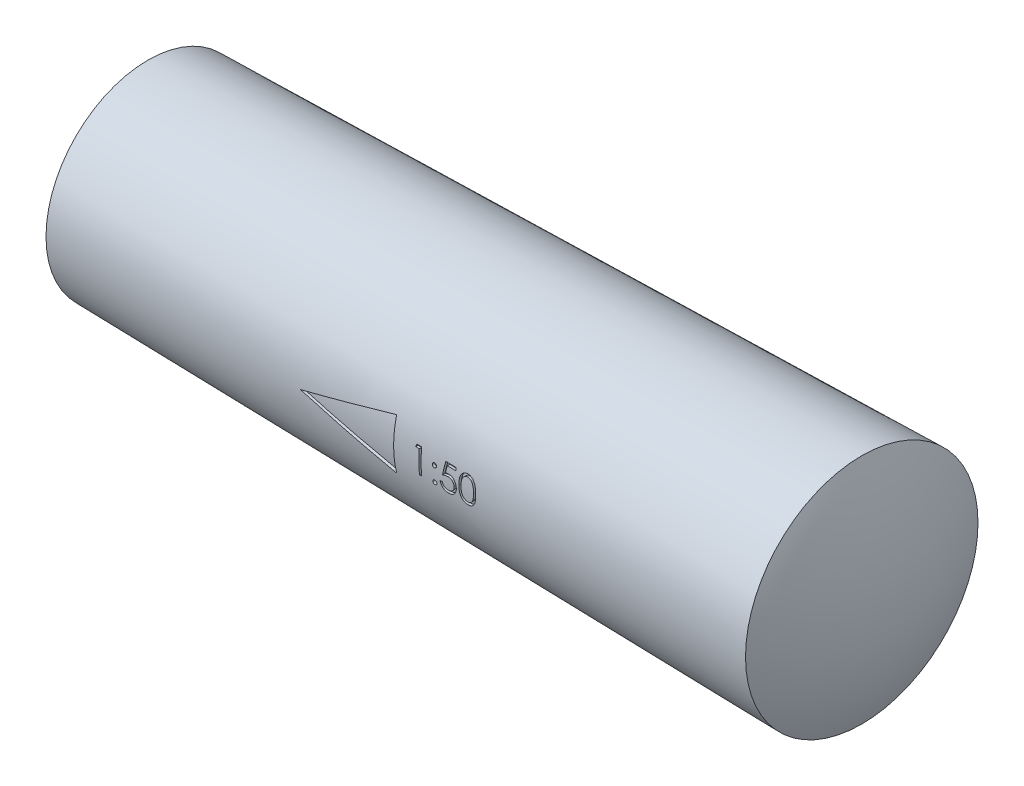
SolidWorks part; units mm, degrees
ref_plane "Front Plane" through (0, 0, 0) normal (0, 0, 1) x (1, 0, 0)
ref_plane "Top Plane" through (0, 0, 0) normal (0, 1, 0) x (1, 0, 0)
ref_plane "Right Plane" through (0, 0, 0) normal (1, 0, 0) x (0, 0, -1)
sketch "Sketch1" plane through (0, 0, 0) normal (1, 0, 0) x (0, 0, -1)
  circle A0 centre (0, 0) radius 4
  dimension "D1" = 8
extrude "Extrude1" add sketch "Sketch1" along normal mid plane 28
draft "Draft1" type of draft neutral plane draft angle 1.146 faces to draft 1 parameters "D1"=1.146
sketch "Sketch2" plane through (0, 0, 0) normal (0, 0, 1) x (1, 0, 0)
  line L0 (-14, 0) -> (-14, 4)
  line L1 (-14, 4) -> (-14, -4) construction
  line L2 (-14, 0) -> (-15, 0)
  line L3 (-15, 0) -> (-15, -4.28) construction
  line L4 (14, 0) -> (14, 4.56)
  line L5 (14, -4.56) -> (14, 4.56) construction
  line L6 (14, 0) -> (15, 0)
  line L7 (15, 0) -> (15, -4.28) construction
  line L8 (-14, -4) -> (14, -4.56) construction
  arc A0 (-15, 0) -> (-14, 4) centre (-6.5, 0) cw
  arc A1 (15, 0) -> (14, 4.56) centre (4.1031, 0) ccw
  point P14 (0, -4.28)
revolve "Revolve1" add sketch "Sketch2" angle 360 about L2
sketch "Sketch5" plane through (0, 0, 0) normal (0, 0, 1) x (1, 0, 0)
  line L0 (0, 4.28) -> (0, -4.28) construction
  line L1 (14, 4.56) -> (-14, 4) construction
  line L2 (-14, -4) -> (14, -4.56) construction
ref_plane "Plane2" through (0, 0, 0) normal (-0.02, 0, 0.9998) x (0.9998, 0, 0.02)
sketch "Sketch6" plane through (0, 0, 0) normal (-0.02, 0, 0.9998) x (0.9998, 0, 0.02)
  line L0 (0, 0) -> (0, 1)
  line L1 (0, 4.28) -> (0, -4.28) construction
  line L2 (0, 1) -> (-3.7321, 0)
  line L3 (-3.7321, 0) -> (0, -1)
  line L4 (0, -1) -> (0, 0)
  line L5 (0, -0.5) -> (4, -0.5) construction
  text T0 "1:50" font "Century Gothic" height 1
  dimension "D1" = 2
  dimension "D2" = 30
  dimension "D3" = 4
wrap "Wrap2" sketch "Sketch6" wrap type deboss source sketch "Sketch6" thickness 0.1 parameters "D1"=0.1
equation "\"D2@Sketch2\" = \"D1@Sketch2\""
